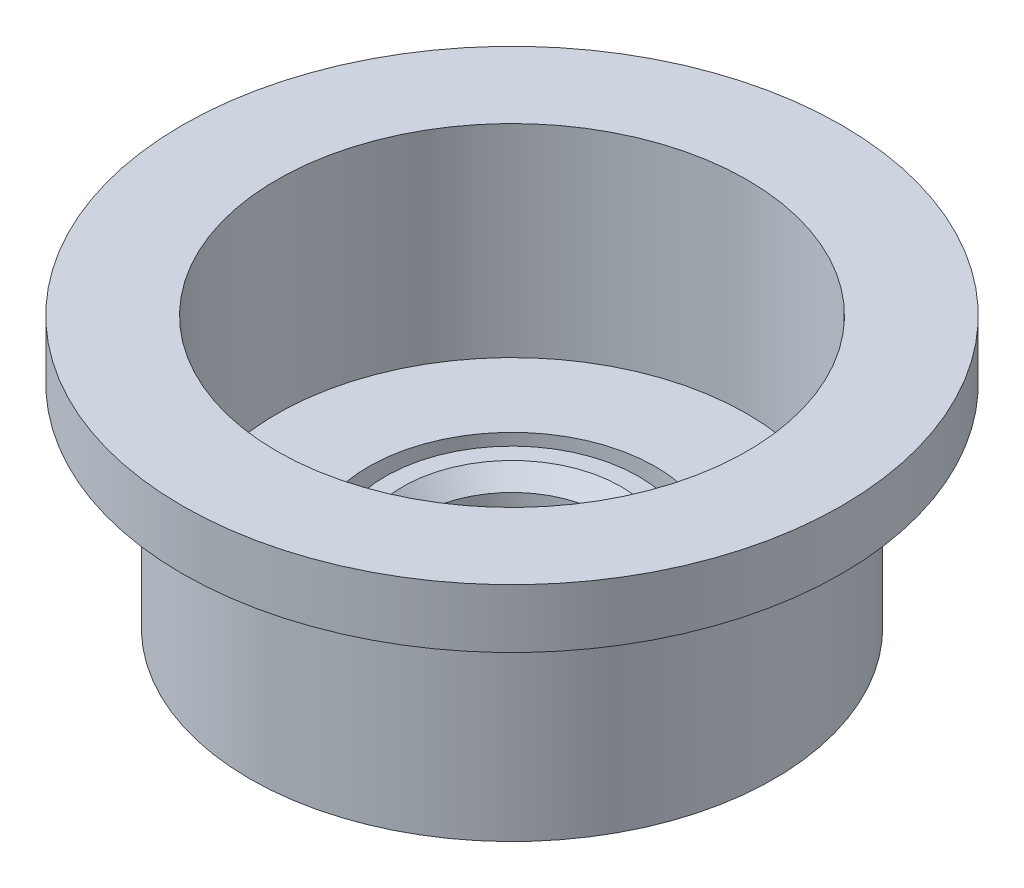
SolidWorks part; units mm, degrees
ref_plane "Front Plane" through (0, 0, 0) normal (0, 0, 1) x (1, 0, 0)
ref_plane "Top Plane" through (0, 0, 0) normal (0, 1, 0) x (1, 0, 0)
ref_plane "Right Plane" through (0, 0, 0) normal (1, 0, 0) x (0, 0, -1)
sketch "Sketch1" plane through (0, 0, 0) normal (1, 0, 0) x (0, 0, -1)
  line L0 (0, 0) -> (0, 282.176) construction
  line L1 (-11.9062, 6.35) -> (-7.62, 6.35)
  line L2 (-24.638, 0) -> (-24.638, 19.8753)
  line L3 (-24.638, 19.8753) -> (-30.988, 19.8753)
  line L4 (-30.988, 19.8753) -> (-30.988, 25.4)
  line L5 (-30.988, 25.4) -> (-22.098, 25.4)
  line L6 (-22.098, 6.35) -> (-13.4937, 6.35)
  line L7 (-24.638, 0) -> (-6.35, 0)
  line L8 (-22.098, 6.35) -> (-22.098, 25.4)
  line L9 (-6.35, 0) -> (-6.35, 4.445)
  line L10 (-12.7, 2.54) -> (-12.7, -2.9029) construction
  line L11 (-13.4937, 6.35) -> (-13.4937, 2.54)
  line L12 (-13.4937, 2.54) -> (-11.9062, 2.54)
  line L13 (-11.9062, 6.35) -> (-11.9062, 2.54)
  line L14 (-7.62, 6.35) -> (-6.35, 4.445)
  point P10 (-6.35, 6.35)
  dimension "D2" = 19.05
  dimension "D3" = 30.988
  dimension "D4" = 6.35
  dimension "D6" = 1.27
  dimension "D7" = 12.7
  dimension "D8" = 2.54
  dimension "D9" = 1.905
  dimension "D10" = 5.5247
  dimension "D11" = 3.81
  dimension "D12" = 2.54
  dimension "D13" = 1.5875
  dimension "D14" = 11.9062
  dimension ".87" = 22.098
revolve "Revolve1" add sketch "Sketch1" angle 360 about L0
hole_wizard "3/4-16 Tapped Hole4" positions "Sketch6" profile "Sketch5" tap size "3/4-16" standard "ANSI Inch"
sketch "Sketch6" plane through (0, 0, 0) normal (0, -1, 0) x (-1, 0, 0)
  point P0 (0, 0)
sketch "Sketch5" plane through (0, 0, 0) normal (1, 0, 0) x (0, 0, -1)
  line L0 (0, 0) -> (0, 25.4)
  line L1 (0, 25.4) -> (8.7312, 25.4)
  line L2 (8.7312, 25.4) -> (8.7312, 0)
  line L5 (8.7312, 0) -> (0, 0)
  line L11 (0, -6.35) -> (0, 107.95) construction
  dimension "Thru Tap Drill Dia." = 17.4625
  dimension "Thru Tap Drill Depth" = 25.4
chamfer "Chamfer1" distance 1.524 angle 45 1 edges at (0, 6.35, -8.7312)
